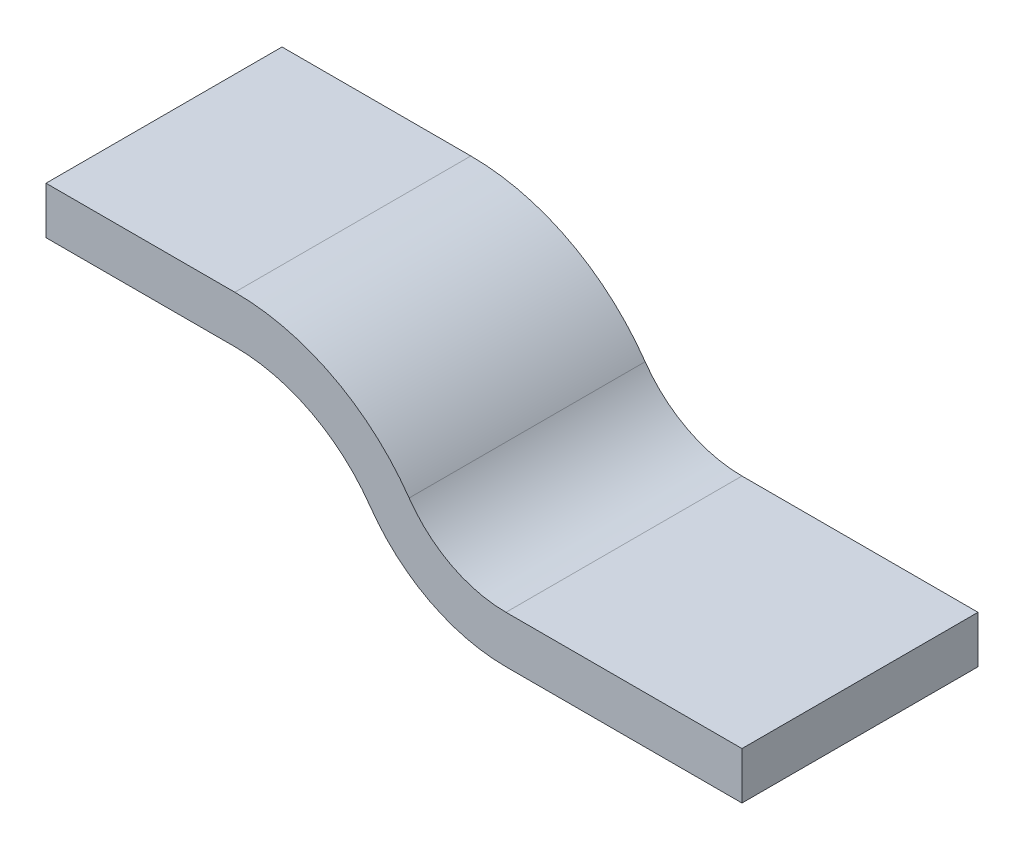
SolidWorks part; units mm, degrees
ref_plane "Front Plane" through (0, 0, 0) normal (0, 0, 1) x (1, 0, 0)
ref_plane "Top Plane" through (0, 0, 0) normal (0, 1, 0) x (1, 0, 0)
ref_plane "Right Plane" through (0, 0, 0) normal (1, 0, 0) x (0, 0, -1)
sketch "Sketch1" plane through (0, 0, 0) normal (0, 0, 1) x (1, 0, 0)
  line L0 (0, 0) -> (40, 0)
  line L1 (97.4456, -30) -> (147.4456, -30)
  arc A0 (40, 0) -> (72.8261, -17.1429) centre (40, -40) cw
  arc A1 (72.8261, -17.1429) -> (97.4456, -30) centre (97.4456, 0) ccw
  dimension "D2" = 40
  dimension "D3" = 30
  dimension "D1" = 40
  dimension "D4" = 50
  dimension "D5" = 30
extrude "Extrude-Thin1" add sketch "Sketch1" along normal mid plane 50 thin
